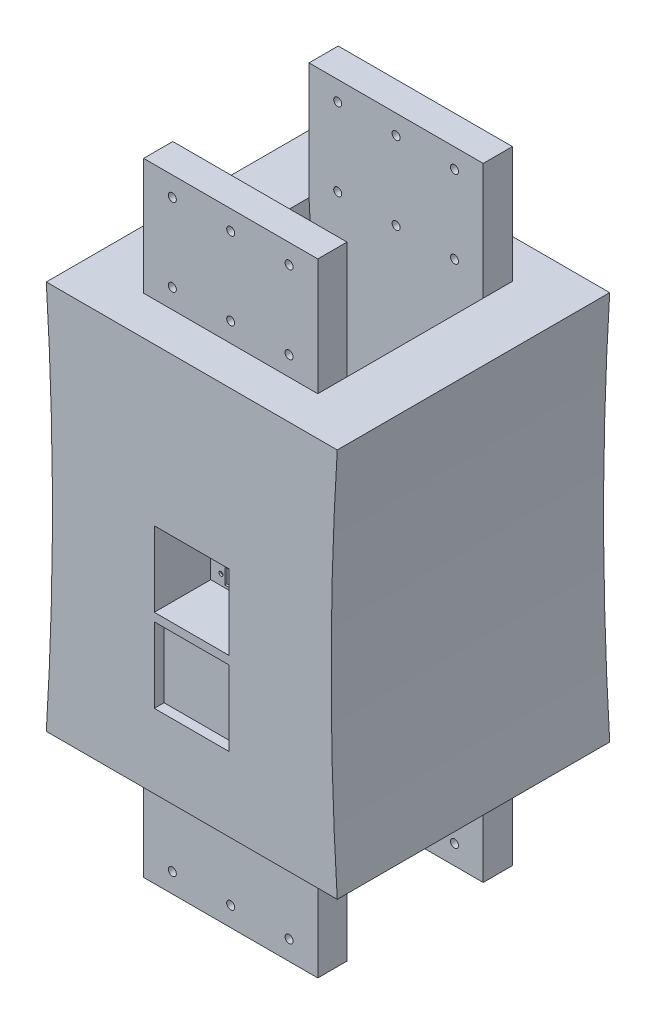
SolidWorks part; units mm, degrees
ref_plane "前视基准面" through (0, 0, 0) normal (0, 0, 1) x (1, 0, 0)
ref_plane "上视基准面" through (0, 0, 0) normal (0, 1, 0) x (1, 0, 0)
ref_plane "右视基准面" through (0, 0, 0) normal (1, 0, 0) x (0, 0, -1)
other "Configuration Table"
sketch "草图2" plane through (0, 0, 0) normal (0, 0, 1) x (1, 0, 0)
  line L1 (0, 0) -> (140, 0)
  line L2 (0, 0) -> (0, 60)
  line L3 (0, 60) -> (140, 60)
  line L4 (140, 0) -> (140, 60)
  line L5 (-30, 110) -> (170, 110)
  line L6 (-30, 110) -> (-30, -3)
  line L7 (-30, -3) -> (170, -3)
  line L8 (170, 110) -> (170, -3)
  dimension "D1" = 140
  dimension "D2" = 60
  dimension "D3" = 30
  dimension "D4" = 30
  dimension "D5" = 50
  dimension "D6" = 3
extrude "凸台-拉伸2" add sketch "草图2" along normal blind 90
sketch "草图4" plane through (0, -3, 0) normal (0, -1, 0) x (1, 0, 0)
  line L4 (-30, 0) -> (170, 0)
  line L5 (170, 0) -> (170, 90)
  line L6 (170, 90) -> (-30, 90)
  line L7 (-30, 90) -> (-30, 0)
  line L8 (-30, 0) -> (170, 0)
  line L9 (170, 0) -> (170, 90)
  line L10 (170, 90) -> (-30, 90)
  line L11 (-30, 90) -> (-30, 0)
  dimension "D1" = 0
extrude "切除-拉伸2" cut sketch "草图4" against normal blind 3
sketch "草图5" plane through (0, 110, 0) normal (0, 1, 0) x (1, 0, 0)
  line L0 (140, -7.5) -> (132.5, -7.5)
  line L1 (132.5, -7.5) -> (132.5, 0)
  line L2 (132.5, -7.5) -> (112.5, -7.5) construction
  line L3 (132.5, -7.5) -> (132.5, -17.5) construction
  line L4 (140, 0) -> (0, 0)
  line L5 (140, -90) -> (140, 0)
  line L6 (0, -90) -> (140, -90)
  line L7 (0, 0) -> (0, -90)
  line L8 (140, 0) -> (0, 0)
  line L9 (140, -90) -> (140, 0)
  line L10 (0, -90) -> (140, -90)
  line L11 (0, 0) -> (0, -90)
  line L12 (70, 0) -> (70, -50000) construction
  circle A0 centre (132.5, -7.5) radius 1.5
  circle A1 centre (112.5, -7.5) radius 1.5
  circle A2 centre (112.5, -17.5) radius 1.5
  circle A3 centre (132.5, -17.5) radius 1.5
  circle A4 centre (27.5, -7.5) radius 1.5
  circle A5 centre (7.5, -7.5) radius 1.5
  circle A6 centre (7.5, -17.5) radius 1.5
  circle A7 centre (27.5, -17.5) radius 1.5
  point P19 (70, 0)
  dimension "D4" = 3
  dimension "D2" = 7.5
  dimension "D3" = 7.5
  dimension "D7" = 20
  dimension "D8" = 10
  dimension "D9" = 20
  dimension "D1" = 0
  dimension "D5" = 2
  dimension "D6" = 2
extrude "切除-拉伸3" cut sketch "草图5" against normal through all contours A6 | A7 | A4 | A5 | A0 | A1 | A2 | A3
sketch "草图6" plane through (0, 0, 0) normal (0, 0, -1) x (-1, 0, 0)
  line L0 (-170, 80) -> (30, 80)
  line L8 (0, 0) -> (30, 0)
  line L9 (30, 0) -> (30, 110)
  line L10 (30, 110) -> (-170, 110)
  line L11 (-170, 110) -> (-170, 0)
  line L12 (-170, 0) -> (-140, 0)
  line L13 (-140, 0) -> (-140, 60)
  line L14 (-140, 60) -> (0, 60)
  line L15 (0, 60) -> (0, 0)
  line L16 (0, 0) -> (30, 0)
  line L17 (30, 0) -> (30, 110)
  line L18 (30, 110) -> (-170, 110)
  line L19 (-170, 110) -> (-170, 0)
  line L20 (-170, 0) -> (-140, 0)
  line L21 (-140, 0) -> (-140, 60)
  line L22 (-140, 60) -> (0, 60)
  line L23 (0, 60) -> (0, 0)
  dimension "D2" = 30
  dimension "D1" = 0
extrude "凸台-拉伸4" add sketch "草图6" along normal blind 50 contours L0 M13 M11 M12
sketch "草图7" plane through (0, 0, -50) normal (0, 0, -1) x (-1, 0, 0)
  line L0 (30, 110) -> (30, 710)
  line L1 (30, 710) -> (-170, 710)
  line L2 (-170, 710) -> (-170, 110)
  line L3 (-70, 710) -> (-70, -49290) construction
  line L4 (-170, 110) -> (-170, 80)
  line L5 (-170, 80) -> (30, 80)
  line L6 (30, 80) -> (30, 110)
  line L7 (30, 110) -> (-170, 110)
  line L8 (-170, 110) -> (-170, 80)
  line L9 (-170, 80) -> (30, 80)
  line L10 (30, 80) -> (30, 110)
  line L11 (30, 110) -> (-170, 110)
  line L12 (-170, 710) -> (-140, 710) construction
  arc A0 (-170, 710) -> (-170, 110) centre (-1741.6234, 410) cw
  arc A1 (30, 710) -> (30, 110) centre (1601.6234, 410) ccw
  arc A2 (-140, 710) -> (-140, 110) centre (-1711.6234, 410) cw
  arc A3 (0, 710) -> (0, 110) centre (1571.6234, 410) ccw
  point P9 (-70, 710)
  dimension "D3" = 1600
  dimension "D2" = 600
  dimension "D5" = 30
  dimension "D1" = 0
  dimension "D4" = 2
extrude "凸台-拉伸5" add sketch "草图7" against normal blind 140 separate body contours A2 L1 A0 L11 | L1 A3 A1 M10
sketch "草图8" plane through (0, 0, -50) normal (0, 0, -1) x (-1, 0, 0)
  line L0 (-170, 110) -> (-170, 410)
  line L1 (-170, 410) -> (-141.6234, 410)
  line L2 (-140, 710) -> (-170, 710)
  line L3 (-170, 110) -> (-140, 110)
  line L4 (-140, 710) -> (-170, 710)
  line L5 (-170, 110) -> (-140, 110)
  line L6 (-140, 710) -> (-10, 710)
  line L7 (-140, 110) -> (0, 110)
  line L9 (30, 710) -> (0, 710)
  line L10 (0, 110) -> (30, 110)
  line L11 (30, 710) -> (0, 710)
  line L12 (0, 110) -> (30, 110)
  arc A2 (-140, 110) -> (-140, 710) centre (-1711.6234, 410) ccw
  arc A3 (-170, 110) -> (-170, 710) centre (-1741.6234, 410) ccw
  arc A4 (-140, 110) -> (-140, 710) centre (-1711.6234, 410) ccw
  arc A5 (-170, 110) -> (-170, 710) centre (-1741.6234, 410) ccw
  arc A6 (0, 710) -> (0, 110) centre (1571.6234, 410) ccw
  arc A7 (30, 710) -> (30, 110) centre (1601.6234, 410) ccw
  arc A8 (0, 710) -> (0, 110) centre (1571.6234, 410) ccw
  arc A9 (30, 710) -> (30, 110) centre (1601.6234, 410) ccw
  dimension "D2" = 0
  dimension "D1" = 0
sketch "草图9" plane through (0, 0, 90) normal (0, 0, 1) x (1, 0, 0)
  line L0 (70, 110) -> (70, 310)
  line L1 (170, 110) -> (-30, 110) construction
  line L2 (70, 310) -> (70, 570)
  line L3 (-30, 710) -> (0, 710) construction
  line L4 (-30, 710) -> (0, 710)
  line L5 (70, 310) -> (70, 240)
  line L7 (70, 570) -> (-372.6545, 570)
  line L8 (70, 570) -> (70, 240)
  line L9 (70, 240) -> (-372.6545, 240)
  line L10 (-372.6545, 570) -> (-372.6545, 240)
  line L11 (70, 570) -> (444.9585, 570)
  line L12 (70, 570) -> (70, 240)
  line L13 (70, 240) -> (444.9585, 240)
  line L14 (444.9585, 570) -> (444.9585, 240)
  line L15 (-372.6545, 240) -> (444.9585, 240)
  line L16 (-372.6545, 240) -> (-372.6545, 39.0962)
  line L17 (-372.6545, 39.0962) -> (444.9585, 39.0962)
  line L18 (444.9585, 240) -> (444.9585, 39.0962)
  line L19 (-372.6545, 570) -> (444.9585, 570)
  line L20 (-372.6545, 570) -> (-372.6545, 815.6567)
  line L21 (-372.6545, 815.6567) -> (444.9585, 815.6567)
  line L22 (444.9585, 570) -> (444.9585, 815.6567)
  dimension "D3" = 70
  dimension "D1" = 200
  dimension "D2" = 260
  dimension "D4" = 442.6545
  dimension "D5" = 374.9585
extrude "切除-拉伸4" cut sketch "草图9" against normal through all
sketch "草图11" plane through (0, 0, 90) normal (0, 0, 1) x (1, 0, 0)
  line L8 (-30, 110) -> (-30, 0)
  line L9 (-30, 0) -> (0, 0)
  line L10 (0, 0) -> (0, 60)
  line L11 (0, 60) -> (140, 60)
  line L12 (140, 60) -> (140, 0)
  line L13 (140, 0) -> (170, 0)
  line L14 (170, 0) -> (170, 110)
  line L15 (170, 110) -> (-30, 110)
  line L16 (-30, 110) -> (-30, 0)
  line L17 (-30, 0) -> (0, 0)
  line L18 (0, 0) -> (0, 60)
  line L19 (0, 60) -> (140, 60)
  line L20 (140, 60) -> (140, 0)
  line L21 (140, 0) -> (170, 0)
  line L22 (170, 0) -> (170, 110)
  line L23 (170, 110) -> (-30, 110)
  dimension "D1" = 0
extrude "切除-拉伸5" cut sketch "草图11" against normal through all
sketch "草图12" plane through (0, 0, 90) normal (0, 0, 1) x (1, 0, 0)
  line L0 (20.3565, 570) -> (119.6435, 570)
  line L1 (0, 110) -> (140, 110)
  line L2 (20.3565, 570) -> (-9.6435, 570)
  line L3 (-30, 110) -> (0, 110)
  line L4 (20.3565, 570) -> (-9.6435, 570)
  line L6 (149.6435, 570) -> (119.6435, 570)
  line L7 (140, 110) -> (170, 110)
  line L8 (149.6435, 570) -> (119.6435, 570)
  line L12 (-30, 110) -> (0, 110)
  line L13 (140, 110) -> (170, 110)
  arc A2 (0, 110) -> (20.3565, 570) centre (-1571.6234, 410) ccw
  arc A3 (-30, 110) -> (-9.6435, 570) centre (-1601.6234, 410) ccw
  arc A4 (0, 110) -> (20.3565, 570) centre (-1571.6234, 410) ccw
  arc A5 (-30, 110) -> (-9.6435, 570) centre (-1601.6234, 410) ccw
  arc A6 (149.6435, 570) -> (170, 110) centre (1741.6234, 410) ccw
  arc A7 (119.6435, 570) -> (140, 110) centre (1711.6234, 410) ccw
  arc A8 (149.6435, 570) -> (170, 110) centre (1741.6234, 410) ccw
  arc A9 (119.6435, 570) -> (140, 110) centre (1711.6234, 410) ccw
  dimension "D1" = 0
  dimension "D2" = 0
extrude "凸台-拉伸7" add sketch "草图12" against normal blind 30 contours A9 L0 L1 M9
sketch "草图13" plane through (0, 0, 90) normal (0, 0, 1) x (1, 0, 0)
  line L0 (-4.7514, 310) -> (25.2486, 310)
  line L1 (114.7514, 310) -> (144.7514, 310)
  line L2 (20.3565, 570) -> (-9.6435, 570)
  line L3 (-30, 110) -> (0, 110)
  line L4 (20.3565, 570) -> (-9.6435, 570)
  line L6 (149.6435, 570) -> (119.6435, 570)
  line L7 (140, 110) -> (170, 110)
  line L8 (149.6435, 570) -> (119.6435, 570)
  line L12 (-30, 110) -> (0, 110)
  line L13 (140, 110) -> (170, 110)
  arc A2 (0, 110) -> (20.3565, 570) centre (-1571.6234, 410) ccw
  arc A3 (-30, 110) -> (-9.6435, 570) centre (-1601.6234, 410) ccw
  arc A4 (0, 110) -> (20.3565, 570) centre (-1571.6234, 410) ccw
  arc A5 (-30, 110) -> (-9.6435, 570) centre (-1601.6234, 410) ccw
  arc A6 (149.6435, 570) -> (170, 110) centre (1741.6234, 410) ccw
  arc A7 (119.6435, 570) -> (140, 110) centre (1711.6234, 410) ccw
  arc A8 (149.6435, 570) -> (170, 110) centre (1741.6234, 410) ccw
  arc A9 (119.6435, 570) -> (140, 110) centre (1711.6234, 410) ccw
  dimension "D1" = 0
  dimension "D2" = 0
extrude "切除-拉伸6" cut sketch "草图13" against normal through all contours A4 L0 M13 M12 | L1 A9 M13 M10
sketch "草图14" plane through (0, 0, -50) normal (0, 0, -1) x (-1, 0, 0)
  line L2 (-144.7514, 310) -> (-114.7514, 310)
  line L3 (-119.6435, 570) -> (-149.6435, 570)
  line L4 (-144.7514, 310) -> (-114.7514, 310)
  line L5 (-119.6435, 570) -> (-149.6435, 570)
  line L6 (-140, 110) -> (0, 110)
  line L7 (-20.3565, 570) -> (-119.6435, 570)
  line L8 (-140, 110) -> (0, 110)
  line L9 (-20.3565, 570) -> (-119.6435, 570)
  arc A2 (-144.7514, 310) -> (-149.6435, 570) centre (-1741.6234, 410) ccw
  arc A3 (-114.7514, 310) -> (-119.6435, 570) centre (-1711.6234, 410) ccw
  arc A4 (-144.7514, 310) -> (-149.6435, 570) centre (-1741.6234, 410) ccw
  arc A5 (-114.7514, 310) -> (-119.6435, 570) centre (-1711.6234, 410) ccw
  arc A8 (-114.7514, 310) -> (-119.6435, 570) centre (-1711.6234, 410) ccw
  arc A9 (-140, 110) -> (-114.7514, 310) centre (-1711.6234, 410) ccw
  arc A10 (-25.2486, 310) -> (0, 110) centre (1571.6234, 410) ccw
  arc A11 (-20.3565, 570) -> (-25.2486, 310) centre (1571.6234, 410) ccw
  arc A12 (-114.7514, 310) -> (-119.6435, 570) centre (-1711.6234, 410) ccw
  arc A13 (-140, 110) -> (-114.7514, 310) centre (-1711.6234, 410) ccw
  arc A14 (-25.2486, 310) -> (0, 110) centre (1571.6234, 410) ccw
  arc A15 (-20.3565, 570) -> (-25.2486, 310) centre (1571.6234, 410) ccw
  dimension "D1" = 0
  dimension "D2" = 0
extrude "凸台-拉伸8" add sketch "草图14" against normal blind 30 contours A15 L9 A13 L8 A14 M13
sketch "草图15" plane through (0, 0, -50) normal (0, 0, -1) x (-1, 0, 0)
  line L0 (-114.7514, 310) -> (-25.2486, 310)
  line L4 (9.6435, 570) -> (-149.6435, 570)
  line L5 (-144.7514, 310) -> (-114.7514, 310)
  line L6 (-140, 110) -> (0, 110)
  line L7 (-25.2486, 310) -> (4.7514, 310)
  line L8 (9.6435, 570) -> (-149.6435, 570)
  line L9 (-144.7514, 310) -> (-114.7514, 310)
  line L10 (-140, 110) -> (0, 110)
  line L11 (-25.2486, 310) -> (4.7514, 310)
  arc A4 (9.6435, 570) -> (4.7514, 310) centre (1601.6234, 410) ccw
  arc A5 (-144.7514, 310) -> (-149.6435, 570) centre (-1741.6234, 410) ccw
  arc A6 (-140, 110) -> (-114.7514, 310) centre (-1711.6234, 410) ccw
  arc A7 (-25.2486, 310) -> (0, 110) centre (1571.6234, 410) ccw
  arc A8 (9.6435, 570) -> (4.7514, 310) centre (1601.6234, 410) ccw
  arc A9 (-144.7514, 310) -> (-149.6435, 570) centre (-1741.6234, 410) ccw
  arc A10 (-140, 110) -> (-114.7514, 310) centre (-1711.6234, 410) ccw
  arc A11 (-25.2486, 310) -> (0, 110) centre (1571.6234, 410) ccw
  dimension "D1" = 0
extrude "切除-拉伸7" cut sketch "草图15" against normal blind 20 contours L0 M13 M14 M15
sketch "草图16" plane through (0, 0, 90) normal (0, 0, 1) x (1, 0, 0)
  line L5 (0, 110) -> (140, 110)
  line L6 (-4.7514, 310) -> (25.2486, 310)
  line L7 (149.6435, 570) -> (-9.6435, 570)
  line L9 (0, 110) -> (140, 110)
  line L11 (149.6435, 570) -> (-9.6435, 570)
  line L12 (-4.7514, 310) -> (25.2486, 310)
  line L13 (114.7514, 310) -> (144.7514, 310)
  line L14 (114.7514, 310) -> (144.7514, 310)
  arc A4 (0, 110) -> (25.2486, 310) centre (-1571.6234, 410) ccw
  arc A5 (0, 110) -> (25.2486, 310) centre (-1571.6234, 410) ccw
  arc A6 (149.6435, 570) -> (144.7514, 310) centre (1741.6234, 410) ccw
  arc A7 (-4.7514, 310) -> (-9.6435, 570) centre (-1601.6234, 410) ccw
  arc A10 (149.6435, 570) -> (144.7514, 310) centre (1741.6234, 410) ccw
  arc A11 (-4.7514, 310) -> (-9.6435, 570) centre (-1601.6234, 410) ccw
  arc A12 (114.7514, 310) -> (140, 110) centre (1711.6234, 410) ccw
  arc A13 (114.7514, 310) -> (140, 110) centre (1711.6234, 410) ccw
  dimension "D1" = 0
extrude "切除-拉伸8" cut sketch "草图16" against normal blind 20
sketch "草图17" plane through (0, 0, 70) normal (0, 0, 1) x (1, 0, 0)
  line L0 (70, 310) -> (70, -49690) construction
  line L1 (100, 250) -> (100, 260)
  line L2 (-4.7514, 310) -> (25.2486, 310)
  line L3 (0, 110) -> (140, 110)
  line L6 (100, 260) -> (70, 260) construction
  line L7 (100, 260) -> (100, 300) construction
  line L8 (100, 260) -> (70, 260) construction
  line L9 (100, 260) -> (100, 300) construction
  line L10 (-4.7514, 310) -> (25.2486, 310)
  line L11 (114.7514, 310) -> (144.7514, 310)
  line L12 (114.7514, 310) -> (144.7514, 310)
  line L13 (149.6435, 570) -> (-9.6435, 570)
  line L14 (149.6435, 570) -> (-9.6435, 570)
  line L17 (0, 110) -> (140, 110)
  circle A0 centre (100, 260) radius 2.0592
  circle A1 centre (70, 260) radius 2.0592
  arc A2 (0, 110) -> (25.2486, 310) centre (-1571.6234, 410) ccw
  arc A3 (114.7514, 310) -> (140, 110) centre (1711.6234, 410) ccw
  arc A4 (0, 110) -> (25.2486, 310) centre (-1571.6234, 410) ccw
  arc A5 (114.7514, 310) -> (140, 110) centre (1711.6234, 410) ccw
  circle A6 centre (40, 260) radius 2.0592
  circle A7 centre (70, 300) radius 2.0592
  circle A8 centre (40, 300) radius 2.0592
  arc A9 (-4.7514, 310) -> (-9.6435, 570) centre (-1601.6234, 410) ccw
  arc A10 (-4.7514, 310) -> (-9.6435, 570) centre (-1601.6234, 410) ccw
  arc A11 (149.6435, 570) -> (144.7514, 310) centre (1741.6234, 410) ccw
  arc A12 (149.6435, 570) -> (144.7514, 310) centre (1741.6234, 410) ccw
  circle A13 centre (100, 300) radius 2.0592
  circle A14 centre (100, 260) radius 5.3
  circle A15 centre (70, 260) radius 5.3
  circle A16 centre (40, 260) radius 5.3
  circle A17 centre (70, 300) radius 5.3
  circle A18 centre (40, 300) radius 5.3
  circle A19 centre (100, 300) radius 5.3
  dimension "D4" = 4.1184
  dimension "D3" = 10.6
  dimension "D2" = 10
  dimension "D5" = 3
  dimension "D7" = 90
  dimension "D8" = 30
  dimension "D9" = 40
  dimension "D10" = 3
  dimension "D12" = 90
  dimension "D13" = 30
  dimension "D14" = 10
  dimension "D1" = 0
  dimension "D6" = 2
  dimension "D11" = 2
extrude "切除-拉伸9" cut sketch "草图17" against normal blind 3 and the other way through all
sketch "草图19" plane through (0, 0, 70) normal (0, 0, 1) x (1, 0, 0)
  circle A1 centre (40, 300) radius 2.0592
  circle A2 centre (40, 300) radius 2.0592
  circle A3 centre (40, 260) radius 2.0592
  circle A4 centre (40, 260) radius 2.0592
  circle A5 centre (70, 260) radius 2.0592
  circle A6 centre (70, 260) radius 2.0592
  circle A7 centre (70, 300) radius 2.0592
  circle A8 centre (70, 300) radius 2.0592
  circle A9 centre (100, 300) radius 2.0592
  circle A10 centre (100, 300) radius 2.0592
  circle A11 centre (100, 260) radius 2.0592
  circle A12 centre (100, 260) radius 2.0592
  dimension "D1" = 0
  dimension "D2" = 0
  dimension "D3" = 0
  dimension "D4" = 0
  dimension "D5" = 0
  dimension "D6" = 0
extrude "切除-拉伸10" cut sketch "草图19" against normal through all
sketch "草图21" plane through (0, 0, 70) normal (0, 0, 1) x (1, 0, 0)
  line L0 (25.2486, 310) -> (114.7514, 310)
  line L4 (-4.7514, 310) -> (25.2486, 310)
  line L5 (0, 110) -> (140, 110)
  line L6 (114.7514, 310) -> (144.7514, 310)
  line L7 (149.6435, 570) -> (-9.6435, 570)
  line L8 (-4.7514, 310) -> (25.2486, 310)
  line L9 (0, 110) -> (140, 110)
  line L10 (114.7514, 310) -> (144.7514, 310)
  line L11 (149.6435, 570) -> (-9.6435, 570)
  arc A4 (-4.7514, 310) -> (-9.6435, 570) centre (-1601.6234, 410) ccw
  arc A5 (0, 110) -> (25.2486, 310) centre (-1571.6234, 410) ccw
  arc A6 (114.7514, 310) -> (140, 110) centre (1711.6234, 410) ccw
  arc A7 (149.6435, 570) -> (144.7514, 310) centre (1741.6234, 410) ccw
  arc A8 (-4.7514, 310) -> (-9.6435, 570) centre (-1601.6234, 410) ccw
  arc A9 (0, 110) -> (25.2486, 310) centre (-1571.6234, 410) ccw
  arc A10 (114.7514, 310) -> (140, 110) centre (1711.6234, 410) ccw
  arc A11 (149.6435, 570) -> (144.7514, 310) centre (1741.6234, 410) ccw
  dimension "D1" = 0
extrude "凸台-拉伸9" add sketch "草图21" along normal blind 20 contours L0 M16 M20 M21 M22 M15
sketch "草图22" plane through (0, 0, -30) normal (0, 0, -1) x (-1, 0, 0)
  line L0 (-76.2881, 310) -> (-76.2881, 250)
  line L1 (-76.2881, 250) -> (-119.6435, 250)
  line L2 (-25.2486, 310) -> (-114.7514, 310)
  line L3 (-140, 110) -> (0, 110)
  line L4 (-25.2486, 310) -> (-114.7514, 310)
  line L5 (-140, 110) -> (0, 110)
  line L6 (-76.2881, 250) -> (-20.3565, 250)
  arc A2 (-140, 110) -> (-114.7514, 310) centre (-1711.6234, 410) ccw
  arc A3 (-25.2486, 310) -> (0, 110) centre (1571.6234, 410) ccw
  arc A4 (-140, 110) -> (-114.7514, 310) centre (-1711.6234, 410) ccw
  arc A5 (-25.2486, 310) -> (0, 110) centre (1571.6234, 410) ccw
  dimension "D2" = 60
  dimension "D1" = 0
extrude "切除-拉伸11" cut sketch "草图22" against normal through all contours L6 L1 M13 M14 M15
sketch "草图23" plane through (0, 0, -20) normal (0, 0, 1) x (1, 0, 0)
  circle A0 centre (70, 300) radius 5.3 construction
  circle A1 centre (70, 300) radius 5.3
  circle A2 centre (40, 300) radius 5.3 construction
  circle A3 centre (40, 300) radius 5.3
  circle A4 centre (40, 260) radius 5.3 construction
  circle A5 centre (100, 300) radius 5.3
  circle A6 centre (100, 300) radius 5.3
  circle A7 centre (40, 260) radius 5.3
  circle A8 centre (70, 260) radius 5.3 construction
  circle A9 centre (70, 260) radius 5.3
  circle A10 centre (100, 260) radius 5.3 construction
  circle A11 centre (100, 260) radius 5.3
  dimension "D1" = 0
extrude "切除-拉伸12" cut sketch "草图23" against normal blind 3
sketch "草图24" plane through (0, 0, 60) normal (0, 0, -1) x (-1, 0, 0)
  circle A0 centre (-100, 300) radius 5.3 construction
  circle A1 centre (-100, 300) radius 5.3
  circle A2 centre (-100, 260) radius 5.3 construction
  circle A3 centre (-100, 260) radius 5.3
  circle A4 centre (-70, 260) radius 5.3 construction
  circle A5 centre (-70, 260) radius 5.3
  circle A6 centre (-70, 300) radius 5.3 construction
  circle A7 centre (-70, 300) radius 5.3
  circle A8 centre (-40, 260) radius 5.3 construction
  circle A9 centre (-40, 300) radius 5.3
  circle A10 centre (-40, 300) radius 5.3
  circle A11 centre (-40, 260) radius 5.3
  dimension "D1" = 0
extrude "切除-拉伸13" cut sketch "草图24" against normal blind 3
sketch "草图25" plane through (0, 0, 70) normal (0, 0, 1) x (1, 0, 0)
  circle A0 centre (40, 300) radius 5.3 construction
  circle A1 centre (40, 300) radius 5.3
  circle A2 centre (100, 300) radius 5.3 construction
  circle A3 centre (70, 300) radius 5.3
  circle A4 centre (70, 300) radius 5.3
  circle A5 centre (100, 300) radius 5.3
  circle A6 centre (40, 260) radius 5.3 construction
  circle A7 centre (40, 260) radius 5.3
  circle A8 centre (70, 260) radius 5.3 construction
  circle A9 centre (70, 260) radius 5.3
  circle A10 centre (100, 260) radius 5.3 construction
  circle A11 centre (100, 260) radius 5.3
  circle A12 centre (40, 300) radius 2.0592 construction
  circle A13 centre (40, 300) radius 2.0592
  circle A14 centre (40, 260) radius 2.0592 construction
  circle A15 centre (40, 260) radius 2.0592
  circle A16 centre (70, 300) radius 2.0592 construction
  circle A17 centre (70, 300) radius 2.0592
  circle A18 centre (70, 260) radius 2.0592 construction
  circle A19 centre (70, 260) radius 2.0592
  circle A20 centre (100, 300) radius 2.0592 construction
  circle A21 centre (100, 300) radius 2.0592
  circle A22 centre (100, 260) radius 2.0592 construction
  circle A23 centre (100, 260) radius 2.0592
  dimension "D1" = 0
extrude "凸台-拉伸11" add sketch "草图25" against normal blind 3 separate body
sketch "草图26" plane through (0, 0, 90) normal (0, 0, 1) x (1, 0, 0)
  line L0 (55.2486, 310) -> (55.2486, 510)
  line L1 (25.2486, 310) -> (114.7514, 310) construction
  line L2 (55.2486, 510) -> (-4.7514, 510)
  line L3 (-4.7514, 510) -> (144.7514, 510)
  line L4 (-4.7514, 310) -> (144.7514, 310)
  line L5 (149.6435, 570) -> (-9.6435, 570)
  line L6 (-4.7514, 310) -> (144.7514, 310)
  line L7 (149.6435, 570) -> (-9.6435, 570)
  line L8 (55.2486, 410) -> (-49944.7514, 410) construction
  line L9 (20.3565, 570) -> (119.6435, 570)
  line L11 (20.3565, 250) -> (119.6435, 250)
  line L12 (114.7514, 310) -> (25.2486, 310)
  line L13 (20.3565, 250) -> (119.6435, 250)
  line L14 (114.7514, 310) -> (25.2486, 310)
  arc A2 (20.3565, 570) -> (25.2486, 510) centre (-1571.6234, 410) cw
  arc A3 (114.7514, 510) -> (119.6435, 570) centre (1711.6234, 410) cw
  arc A4 (149.6435, 570) -> (144.7514, 310) centre (1741.6234, 410) ccw
  arc A5 (-4.7514, 310) -> (-9.6435, 570) centre (-1601.6234, 410) ccw
  arc A6 (149.6435, 570) -> (144.7514, 310) centre (1741.6234, 410) ccw
  arc A7 (-4.7514, 310) -> (-9.6435, 570) centre (-1601.6234, 410) ccw
  arc A8 (20.3565, 250) -> (25.2486, 310) centre (-1571.6234, 410) ccw
  arc A9 (114.7514, 310) -> (119.6435, 250) centre (1711.6234, 410) ccw
  arc A10 (20.3565, 250) -> (25.2486, 310) centre (-1571.6234, 410) ccw
  arc A11 (114.7514, 310) -> (119.6435, 250) centre (1711.6234, 410) ccw
  point P4 (55.2486, 410)
  dimension "D3" = 60
  dimension "D4" = 0
  dimension "D2" = 0
extrude "切除-拉伸14" cut sketch "草图26" against normal through all contours A2 L3 M8 M9 | A3 L3 M7 M8
sketch "草图29" plane through (0, 0, -50) normal (0, 0, -1) x (-1, 0, 0)
  line L0 (-141.6234, 410) -> (49858.3766, 410) construction
  line L1 (-114.7514, 510) -> (-25.2486, 510)
  line L4 (4.7514, 510) -> (-25.2486, 510)
  line L5 (-20.3565, 570) -> (-119.6435, 570)
  line L6 (-114.7514, 510) -> (-144.7514, 510)
  line L7 (-144.7514, 310) -> (4.7514, 310)
  line L8 (4.7514, 510) -> (-25.2486, 510)
  line L9 (-20.3565, 570) -> (-119.6435, 570)
  line L10 (-114.7514, 510) -> (-144.7514, 510)
  line L11 (-144.7514, 310) -> (4.7514, 310)
  circle A0 centre (-40, 260) radius 2.0592 construction
  circle A1 centre (-40, 300) radius 2.0592 construction
  circle A2 centre (-70, 300) radius 2.0592 construction
  circle A3 centre (-70, 260) radius 2.0592 construction
  arc A4 (-20.3565, 570) -> (-25.2486, 510) centre (1571.6234, 410) ccw
  arc A5 (-114.7514, 510) -> (-119.6435, 570) centre (-1711.6234, 410) ccw
  arc A6 (-144.7514, 310) -> (-144.7514, 510) centre (-1741.6234, 410) ccw
  arc A7 (4.7514, 510) -> (4.7514, 310) centre (1601.6234, 410) ccw
  arc A8 (-20.3565, 570) -> (-25.2486, 510) centre (1571.6234, 410) ccw
  arc A9 (-114.7514, 510) -> (-119.6435, 570) centre (-1711.6234, 410) ccw
  arc A10 (-144.7514, 310) -> (-144.7514, 510) centre (-1741.6234, 410) ccw
  arc A11 (4.7514, 510) -> (4.7514, 310) centre (1601.6234, 410) ccw
  circle A12 centre (-100, 260) radius 2.0592 construction
  circle A13 centre (-100, 300) radius 2.0592 construction
  circle A14 centre (-40, 260) radius 2.0592
  circle A15 centre (-40, 300) radius 2.0592
  circle A16 centre (-70, 300) radius 2.0592
  circle A17 centre (-70, 260) radius 2.0592
  circle A18 centre (-100, 260) radius 2.0592
  circle A19 centre (-100, 300) radius 2.0592
  circle A20 centre (-70, 520) radius 2.0592
  circle A21 centre (-100, 520) radius 2.0592
  circle A22 centre (-100, 560) radius 2.0592
  circle A23 centre (-70, 560) radius 2.0592
  circle A24 centre (-40, 560) radius 2.0592
  circle A25 centre (-40, 520) radius 2.0592
  point P12 (-141.6234, 410)
  dimension "D1" = 0
extrude "切除-拉伸16" cut sketch "草图29" against normal blind 20 contours L1 A24 A22 A20 A21 A23 A25 M13 M11 M12
sketch "草图30" plane through (0, 0, -50) normal (0, 0, -1) x (-1, 0, 0)
  circle A1 centre (-100, 520) radius 2.0592
  circle A3 centre (-100, 560) radius 2.0592
  circle A5 centre (-70, 560) radius 2.0592
  circle A7 centre (-70, 520) radius 2.0592
  circle A9 centre (-40, 560) radius 2.0592
  circle A11 centre (-40, 520) radius 2.0592
  circle A13 centre (-100, 520) radius 2.0592
  circle A14 centre (-100, 560) radius 2.0592
  circle A15 centre (-70, 560) radius 2.0592
  circle A17 centre (-70, 520) radius 2.0592
  circle A19 centre (-40, 560) radius 2.0592
  circle A21 centre (-40, 520) radius 2.0592
  dimension "D1" = 0
  dimension "D2" = 0
  dimension "D3" = 0
  dimension "D4" = 0
  dimension "D5" = 0
  dimension "D6" = 0
extrude "切除-拉伸17" cut sketch "草图30" against normal through all both and the other way through all
sketch "草图31" plane through (0, 0, 90) normal (0, 0, 1) x (1, 0, 0)
  line L2 (25.2486, 510) -> (114.7514, 510)
  line L3 (119.6435, 570) -> (20.3565, 570)
  line L4 (25.2486, 510) -> (114.7514, 510)
  line L5 (119.6435, 570) -> (20.3565, 570)
  arc A2 (119.6435, 570) -> (114.7514, 510) centre (1711.6234, 410) ccw
  arc A3 (25.2486, 510) -> (20.3565, 570) centre (-1571.6234, 410) ccw
  arc A4 (119.6435, 570) -> (114.7514, 510) centre (1711.6234, 410) ccw
  arc A5 (25.2486, 510) -> (20.3565, 570) centre (-1571.6234, 410) ccw
  dimension "D1" = 0
extrude "切除-拉伸18" cut sketch "草图31" against normal blind 20 and the other way through all
sketch "草图32" plane through (0, 0, -20) normal (0, 0, 1) x (1, 0, 0)
  line L0 (-1.6234, 410) -> (49998.3766, 410) construction
  arc A0 (-4.7514, 310) -> (-4.7514, 510) centre (-1601.6234, 410) ccw construction
  circle A1 centre (40, 300) radius 5.3 construction
  circle A2 centre (40, 300) radius 5.3
  circle A3 centre (70, 260) radius 5.3 construction
  circle A4 centre (100, 260) radius 5.3 construction
  circle A5 centre (100, 300) radius 5.3 construction
  circle A6 centre (70, 300) radius 5.3 construction
  circle A7 centre (40, 260) radius 5.3 construction
  circle A8 centre (70, 260) radius 5.3
  circle A9 centre (100, 260) radius 5.3
  circle A10 centre (100, 300) radius 5.3
  circle A11 centre (70, 300) radius 5.3
  circle A12 centre (40, 260) radius 5.3
  circle A13 centre (100, 560) radius 5.3
  circle A14 centre (70, 560) radius 5.3
  circle A15 centre (40, 560) radius 5.3
  circle A16 centre (40, 520) radius 5.3
  circle A17 centre (100, 520) radius 5.3
  circle A18 centre (70, 520) radius 5.3
  point P5 (-1.6234, 410)
extrude "切除-拉伸19" cut sketch "草图32" against normal blind 3
sketch "草图33" plane through (0, 0, 60) normal (0, 0, -1) x (-1, 0, 0)
  circle A0 centre (-100, 560) radius 5.3 construction
  circle A1 centre (-100, 560) radius 5.3
  circle A2 centre (-100, 520) radius 5.3 construction
  circle A3 centre (-100, 520) radius 5.3
  circle A4 centre (-70, 520) radius 5.3 construction
  circle A5 centre (-70, 520) radius 5.3
  circle A6 centre (-40, 520) radius 5.3 construction
  circle A7 centre (-40, 520) radius 5.3
  circle A8 centre (-40, 560) radius 5.3 construction
  circle A9 centre (-40, 560) radius 5.3
  circle A10 centre (-70, 560) radius 5.3 construction
  circle A11 centre (-70, 560) radius 5.3
extrude "切除-拉伸20" cut sketch "草图33" against normal blind 3
sketch "草图35" plane through (0, 0, 90) normal (0, 0, 1) x (1, 0, 0)
  line L0 (70, 510) -> (70, 310)
  line L2 (144.7514, 510) -> (-4.7514, 510)
  line L3 (-4.7514, 310) -> (144.7514, 310)
  line L4 (144.7514, 510) -> (-4.7514, 510)
  line L5 (-4.7514, 310) -> (144.7514, 310)
  line L6 (50.75, 429.25) -> (89.25, 429.25)
  line L7 (50.75, 429.25) -> (50.75, 390.75)
  line L8 (50.75, 390.75) -> (89.25, 390.75)
  line L9 (89.25, 429.25) -> (89.25, 390.75)
  line L10 (50.75, 429.25) -> (89.25, 390.75) construction
  line L11 (50.75, 390.75) -> (89.25, 429.25) construction
  arc A2 (144.7514, 510) -> (144.7514, 310) centre (1741.6234, 410) ccw
  arc A3 (-4.7514, 310) -> (-4.7514, 510) centre (-1601.6234, 410) ccw
  arc A4 (144.7514, 510) -> (144.7514, 310) centre (1741.6234, 410) ccw
  arc A5 (-4.7514, 310) -> (-4.7514, 510) centre (-1601.6234, 410) ccw
  point P8 (70, 410)
  dimension "D2" = 38.5
  dimension "D3" = 38.5
  dimension "D1" = 0
extrude "切除-拉伸21" cut sketch "草图35" against normal blind 29 contours L7 L8 L0 L6 | L9 L6 L0 L8
sketch "草图36" plane through (0, 0, 61) normal (0, 0, 1) x (1, 0, 0)
  line L4 (50.75, 429.25) -> (50.75, 390.75)
  line L5 (50.75, 390.75) -> (89.25, 390.75)
  line L6 (89.25, 390.75) -> (89.25, 429.25)
  line L7 (89.25, 429.25) -> (50.75, 429.25)
  line L8 (50.75, 429.25) -> (50.75, 390.75)
  line L9 (50.75, 390.75) -> (89.25, 390.75)
  line L10 (89.25, 390.75) -> (89.25, 429.25)
  line L11 (89.25, 429.25) -> (50.75, 429.25)
  dimension "D1" = 0
extrude "凸台-拉伸12" add sketch "草图36" against normal blind 2
sketch "草图37" plane through (0, 0, 61) normal (0, 0, 1) x (1, 0, 0)
  line L0 (50.75, 410) -> (89.25, 410)
  line L1 (70, 410) -> (70, 424)
  line L2 (70, 424) -> (84, 424)
  line L4 (50.75, 429.25) -> (50.75, 390.75)
  line L5 (50.75, 390.75) -> (89.25, 390.75)
  line L6 (89.25, 390.75) -> (89.25, 429.25)
  line L7 (89.25, 429.25) -> (50.75, 429.25)
  line L8 (50.75, 429.25) -> (50.75, 390.75)
  line L9 (50.75, 390.75) -> (89.25, 390.75)
  line L10 (89.25, 390.75) -> (89.25, 429.25)
  line L11 (89.25, 429.25) -> (50.75, 429.25)
  circle A0 centre (84, 424) radius 1.05
  circle A1 centre (84, 396) radius 1.05
  circle A2 centre (56, 396) radius 1.05
  circle A3 centre (56, 424) radius 1.05
  dimension "D4" = 2.1
  dimension "D2" = 14
  dimension "D3" = 14
  dimension "D1" = 0
extrude "切除-拉伸22" cut sketch "草图37" against normal blind 3 contours A2 | A1 | A0 | A3
sketch "草图39" plane through (0, 0, 61) normal (0, 0, 1) x (1, 0, 0)
  line L0 (84, 396) -> (82, 396)
  line L1 (82, 396) -> (82, 400)
  line L2 (82, 400) -> (70, 400)
  line L3 (70, 400) -> (70, 392)
  line L4 (50.75, 429.25) -> (50.75, 390.75)
  line L5 (50.75, 390.75) -> (89.25, 390.75)
  line L6 (89.25, 390.75) -> (89.25, 429.25)
  line L7 (89.25, 429.25) -> (50.75, 429.25)
  line L8 (50.75, 429.25) -> (50.75, 390.75)
  line L9 (50.75, 390.75) -> (89.25, 390.75)
  line L10 (89.25, 390.75) -> (89.25, 429.25)
  line L11 (89.25, 429.25) -> (50.75, 429.25)
  line L12 (70, 392) -> (82, 392)
  line L13 (82, 392) -> (82, 396)
  line L14 (70, 390.75) -> (70, 50390.75) construction
  line L15 (50.75, 410) -> (50050.75, 410) construction
  line L16 (58, 396) -> (58, 400)
  line L17 (58, 392) -> (58, 396)
  line L18 (70, 392) -> (58, 392)
  line L19 (70, 400) -> (70, 392)
  line L20 (58, 400) -> (70, 400)
  line L21 (82, 424) -> (82, 420)
  line L22 (82, 428) -> (82, 424)
  line L23 (58, 428) -> (82, 428)
  line L24 (70, 420) -> (70, 428)
  line L25 (82, 420) -> (58, 420)
  line L26 (58, 424) -> (58, 420)
  line L27 (58, 428) -> (58, 424)
  circle A0 centre (84, 396) radius 1.05 construction
  circle A1 centre (84, 396) radius 1.05
  circle A2 centre (56, 424) radius 1.05 construction
  circle A3 centre (56, 424) radius 1.05
  circle A5 centre (84, 424) radius 1.05 construction
  circle A6 centre (84, 424) radius 1.05
  circle A7 centre (56, 396) radius 1.05 construction
  circle A8 centre (56, 396) radius 1.05
  point P19 (70, 390.75)
  point P20 (50.75, 410)
  dimension "D2" = 2
  dimension "D3" = 12
  dimension "D4" = 8
  dimension "D5" = 4
  dimension "D1" = 0
extrude "切除-拉伸23" cut sketch "草图39" against normal blind 30 contours L20 L16 L17 L18 L19 | L12 L13 L1 L2 L3 | L23 L27 L26 L25 L24 | L25 L21 L22 L23 L24 | A3 | A8 | A1 | A6
sketch "草图40" plane through (0, 0, 60) normal (0, 0, -1) x (-1, 0, 0)
  line L2 (-119.6435, 250) -> (-20.3565, 250)
  line L3 (-20.3565, 570) -> (-119.6435, 570)
  line L4 (-119.6435, 250) -> (-20.3565, 250)
  arc A6 (-25.2486, 310) -> (-20.3565, 250) centre (1571.6234, 410) ccw
  arc A7 (-25.2486, 510) -> (-25.2486, 310) centre (1571.6234, 410) ccw
  arc A8 (-20.3565, 570) -> (-25.2486, 510) centre (1571.6234, 410) ccw
  arc A9 (-114.7514, 510) -> (-119.6435, 570) centre (-1711.6234, 410) ccw
  arc A10 (-114.7514, 310) -> (-114.7514, 510) centre (-1711.6234, 410) ccw
  arc A11 (-119.6435, 250) -> (-114.7514, 310) centre (-1711.6234, 410) ccw
  arc A12 (-25.2486, 310) -> (-20.3565, 250) centre (1571.6234, 410) ccw
  arc A13 (-25.2486, 510) -> (-25.2486, 310) centre (1571.6234, 410) ccw
  arc A14 (-20.3565, 570) -> (-25.2486, 510) centre (1571.6234, 410) ccw
  arc A15 (-114.7514, 510) -> (-119.6435, 570) centre (-1711.6234, 410) ccw
  arc A16 (-114.7514, 310) -> (-114.7514, 510) centre (-1711.6234, 410) ccw
  arc A17 (-119.6435, 250) -> (-114.7514, 310) centre (-1711.6234, 410) ccw
  circle A24 centre (-100, 560) radius 5.5
  circle A25 centre (-70, 560) radius 5.5
  circle A26 centre (-40, 560) radius 5.5
  circle A27 centre (-70, 520) radius 5.5
  circle A28 centre (-40, 520) radius 5.5
  circle A29 centre (-100, 520) radius 5.5
  dimension "D2" = 11
  dimension "D1" = 0
  dimension "D3" = 3
  dimension "D4" = 2
extrude "切除-拉伸24" cut sketch "草图40" against normal blind 3 contours A25 | A26 | A24 | A28 | A27 | A29
sketch "草图41" plane through (0, 0, -20) normal (0, 0, 1) x (1, 0, 0)
  circle A0 centre (100, 560) radius 5.5 construction
  circle A1 centre (40, 560) radius 5.5 construction
  circle A2 centre (70, 560) radius 5.5 construction
  circle A3 centre (100, 560) radius 5.5
  circle A4 centre (40, 560) radius 5.5
  circle A5 centre (70, 560) radius 5.5
  circle A6 centre (40, 520) radius 5.5 construction
  circle A7 centre (70, 520) radius 5.5 construction
  circle A8 centre (100, 520) radius 5.5 construction
  circle A9 centre (40, 520) radius 5.5
  circle A10 centre (70, 520) radius 5.5
  circle A11 centre (100, 520) radius 5.5
extrude "切除-拉伸25" cut sketch "草图41" against normal blind 3
sketch "草图42" plane through (0, 0, 60) normal (0, 0, -1) x (-1, 0, 0)
  line L0 (-111.6234, 410) -> (-50111.6234, 410) construction
  line L2 (-119.6435, 250) -> (-20.3565, 250)
  line L3 (-20.3565, 570) -> (-119.6435, 570)
  line L4 (-119.6435, 250) -> (-20.3565, 250)
  line L5 (-20.3565, 570) -> (-119.6435, 570)
  circle A0 centre (-40, 520) radius 5.5 construction
  circle A1 centre (-70, 520) radius 5.5 construction
  circle A2 centre (-70, 560) radius 5.5 construction
  circle A3 centre (-40, 560) radius 5.5 construction
  circle A4 centre (-100, 560) radius 5.5 construction
  circle A5 centre (-100, 520) radius 5.5 construction
  arc A6 (-25.2486, 310) -> (-20.3565, 250) centre (1571.6234, 410) ccw
  arc A7 (-25.2486, 510) -> (-25.2486, 310) centre (1571.6234, 410) ccw
  arc A8 (-20.3565, 570) -> (-25.2486, 510) centre (1571.6234, 410) ccw
  arc A9 (-114.7514, 510) -> (-119.6435, 570) centre (-1711.6234, 410) ccw
  arc A10 (-114.7514, 310) -> (-114.7514, 510) centre (-1711.6234, 410) ccw
  arc A11 (-119.6435, 250) -> (-114.7514, 310) centre (-1711.6234, 410) ccw
  arc A12 (-25.2486, 310) -> (-20.3565, 250) centre (1571.6234, 410) ccw
  arc A13 (-25.2486, 510) -> (-25.2486, 310) centre (1571.6234, 410) ccw
  arc A15 (-114.7514, 510) -> (-119.6435, 570) centre (-1711.6234, 410) ccw
  arc A16 (-114.7514, 310) -> (-114.7514, 510) centre (-1711.6234, 410) ccw
  arc A17 (-119.6435, 250) -> (-114.7514, 310) centre (-1711.6234, 410) ccw
  circle A18 centre (-40, 520) radius 5.5
  circle A19 centre (-70, 520) radius 5.5
  circle A20 centre (-70, 560) radius 5.5
  circle A21 centre (-40, 560) radius 5.5
  circle A22 centre (-100, 560) radius 5.5
  circle A23 centre (-100, 520) radius 5.5
  circle A24 centre (-40, 300) radius 5.5
  circle A25 centre (-70, 300) radius 5.5
  circle A26 centre (-100, 300) radius 5.5
  circle A27 centre (-100, 260) radius 5.5
  circle A28 centre (-70, 260) radius 5.5
  circle A29 centre (-40, 260) radius 5.5
  point P8 (-111.6234, 410)
  dimension "D1" = 0
extrude "切除-拉伸26" cut sketch "草图42" against normal blind 3 contours A24 | A25 | A26 | A27 | A28 | A29
sketch "草图43" plane through (0, 0, -20) normal (0, 0, 1) x (1, 0, 0)
  line L0 (111.6234, 410) -> (50111.6234, 410) construction
  line L2 (20.3565, 250) -> (119.6435, 250)
  line L3 (119.6435, 570) -> (20.3565, 570)
  line L4 (20.3565, 250) -> (119.6435, 250)
  line L5 (119.6435, 570) -> (20.3565, 570)
  circle A0 centre (40, 520) radius 5.5 construction
  circle A1 centre (70, 520) radius 5.5 construction
  circle A2 centre (100, 520) radius 5.5 construction
  circle A3 centre (100, 560) radius 5.5 construction
  circle A4 centre (70, 560) radius 5.5 construction
  circle A5 centre (40, 560) radius 5.5 construction
  arc A6 (114.7514, 310) -> (119.6435, 250) centre (1711.6234, 410) ccw
  arc A7 (114.7514, 510) -> (114.7514, 310) centre (1711.6234, 410) ccw
  arc A8 (119.6435, 570) -> (114.7514, 510) centre (1711.6234, 410) ccw
  arc A9 (25.2486, 510) -> (20.3565, 570) centre (-1571.6234, 410) ccw
  arc A10 (25.2486, 310) -> (25.2486, 510) centre (-1571.6234, 410) ccw
  arc A11 (20.3565, 250) -> (25.2486, 310) centre (-1571.6234, 410) ccw
  arc A12 (114.7514, 310) -> (119.6435, 250) centre (1711.6234, 410) ccw
  arc A14 (119.6435, 570) -> (114.7514, 510) centre (1711.6234, 410) ccw
  arc A15 (25.2486, 510) -> (20.3565, 570) centre (-1571.6234, 410) ccw
  arc A16 (25.2486, 310) -> (25.2486, 510) centre (-1571.6234, 410) ccw
  arc A17 (20.3565, 250) -> (25.2486, 310) centre (-1571.6234, 410) ccw
  circle A18 centre (40, 520) radius 5.5
  circle A19 centre (70, 520) radius 5.5
  circle A20 centre (100, 520) radius 5.5
  circle A21 centre (100, 560) radius 5.5
  circle A22 centre (70, 560) radius 5.5
  circle A23 centre (40, 560) radius 5.5
  circle A24 centre (100, 300) radius 5.5
  circle A25 centre (100, 260) radius 5.5
  circle A26 centre (70, 260) radius 5.5
  circle A27 centre (40, 260) radius 5.5
  circle A28 centre (40, 300) radius 5.5
  circle A29 centre (70, 300) radius 5.5
  dimension "D1" = 0
extrude "切除-拉伸27" cut sketch "草图43" against normal blind 3 contours A25 | A26 | A24 | A29 | A27 | A28
sketch "草图44" plane through (0, 0, -20) normal (0, 0, 1) x (1, 0, 0)
  line L0 (25.2486, 510) -> (25.2486, 570)
  line L1 (114.7514, 510) -> (114.7514, 570)
  line L2 (20.3565, 250) -> (119.6435, 250)
  line L3 (119.6435, 570) -> (20.3565, 570)
  line L4 (20.3565, 250) -> (119.6435, 250)
  line L5 (119.6435, 570) -> (20.3565, 570)
  arc A6 (114.7514, 310) -> (119.6435, 250) centre (1711.6234, 410) ccw
  arc A7 (114.7514, 510) -> (114.7514, 310) centre (1711.6234, 410) ccw
  arc A8 (119.6435, 570) -> (114.7514, 510) centre (1711.6234, 410) ccw
  arc A9 (25.2486, 510) -> (20.3565, 570) centre (-1571.6234, 410) ccw
  arc A10 (25.2486, 310) -> (25.2486, 510) centre (-1571.6234, 410) ccw
  arc A11 (20.3565, 250) -> (25.2486, 310) centre (-1571.6234, 410) ccw
  arc A12 (114.7514, 310) -> (119.6435, 250) centre (1711.6234, 410) ccw
  arc A13 (114.7514, 510) -> (114.7514, 310) centre (1711.6234, 410) ccw
  arc A14 (119.6435, 570) -> (114.7514, 510) centre (1711.6234, 410) ccw
  arc A15 (25.2486, 510) -> (20.3565, 570) centre (-1571.6234, 410) ccw
  arc A16 (25.2486, 310) -> (25.2486, 510) centre (-1571.6234, 410) ccw
  arc A17 (20.3565, 250) -> (25.2486, 310) centre (-1571.6234, 410) ccw
  dimension "D1" = 0
extrude "切除-拉伸28" cut sketch "草图44" against normal through all both and the other way through all contours L0 M31 M30 | L1 M29 M30
sketch "草图45" plane through (0, 0, 70) normal (0, 0, 1) x (1, 0, 0)
  line L0 (25.2486, 310) -> (25.2486, 250)
  line L1 (114.7514, 310) -> (114.7514, 250)
  line L2 (20.3565, 250) -> (119.6435, 250)
  line L3 (114.7514, 310) -> (25.2486, 310)
  line L4 (20.3565, 250) -> (119.6435, 250)
  line L5 (114.7514, 310) -> (25.2486, 310)
  arc A2 (20.3565, 250) -> (25.2486, 310) centre (-1571.6234, 410) ccw
  arc A3 (114.7514, 310) -> (119.6435, 250) centre (1711.6234, 410) ccw
  arc A4 (20.3565, 250) -> (25.2486, 310) centre (-1571.6234, 410) ccw
  arc A5 (114.7514, 310) -> (119.6435, 250) centre (1711.6234, 410) ccw
  dimension "D1" = 0
extrude "切除-拉伸29" cut sketch "草图45" against normal through all both and the other way through all contours L0 M11 M12 | L1 M13 M12
sketch "草图46" plane through (0, 0, 60) normal (0, 0, -1) x (-1, 0, 0)
  circle A0 centre (-100, 300) radius 2.0592 construction
  circle A1 centre (-100, 300) radius 2.0592
  circle A2 centre (-100, 300) radius 5.5 construction
  circle A3 centre (-100, 300) radius 5.5
  circle A4 centre (-100, 260) radius 2.0592 construction
  circle A5 centre (-100, 260) radius 5.5 construction
  circle A6 centre (-100, 260) radius 2.0592
  circle A7 centre (-100, 260) radius 5.5
  circle A8 centre (-70, 300) radius 2.0592 construction
  circle A9 centre (-70, 300) radius 5.5 construction
  circle A10 centre (-70, 300) radius 2.0592
  circle A11 centre (-70, 300) radius 5.5
  circle A12 centre (-70, 260) radius 2.0592 construction
  circle A13 centre (-70, 260) radius 5.5 construction
  circle A14 centre (-70, 260) radius 2.0592
  circle A15 centre (-70, 260) radius 5.5
  circle A16 centre (-40, 300) radius 2.0592 construction
  circle A17 centre (-40, 300) radius 5.5 construction
  circle A18 centre (-40, 300) radius 2.0592
  circle A19 centre (-40, 300) radius 5.5
  circle A20 centre (-40, 260) radius 2.0592 construction
  circle A21 centre (-40, 260) radius 2.0592
  circle A22 centre (-40, 260) radius 5.5 construction
  circle A23 centre (-40, 260) radius 5.5
extrude "凸台-拉伸13" add sketch "草图46" against normal blind 10
sketch "草图47" plane through (0, 0, -20) normal (0, 0, 1) x (1, 0, 0)
  circle A0 centre (100, 300) radius 2.0592 construction
  circle A1 centre (70, 300) radius 2.0592 construction
  circle A2 centre (40, 300) radius 2.0592 construction
  circle A3 centre (100, 300) radius 2.0592
  circle A4 centre (70, 300) radius 2.0592
  circle A5 centre (40, 300) radius 2.0592
  circle A6 centre (100, 260) radius 5.5 construction
  circle A7 centre (70, 260) radius 5.5 construction
  circle A8 centre (40, 260) radius 5.5 construction
  circle A9 centre (100, 260) radius 2.0592 construction
  circle A10 centre (70, 260) radius 2.0592 construction
  circle A11 centre (40, 260) radius 2.0592 construction
  circle A12 centre (100, 260) radius 5.5
  circle A13 centre (70, 260) radius 5.5
  circle A14 centre (40, 260) radius 5.5
  circle A15 centre (100, 260) radius 2.0592
  circle A16 centre (70, 260) radius 2.0592
  circle A17 centre (40, 260) radius 2.0592
  circle A18 centre (100, 300) radius 5.5 construction
  circle A19 centre (40, 300) radius 5.5 construction
  circle A20 centre (100, 300) radius 5.5
  circle A21 centre (40, 300) radius 5.5
  circle A23 centre (70, 300) radius 5.5
  circle A24 centre (70, 300) radius 5.5
  dimension "D1" = 0
extrude "凸台-拉伸14" add sketch "草图47" against normal blind 10
sketch "草图48" plane through (0, 0, -20) normal (0, 0, 1) x (1, 0, 0)
  circle A0 centre (40, 560) radius 5.5 construction
  circle A1 centre (40, 560) radius 5.5
  circle A2 centre (100, 560) radius 5.5 construction
  circle A3 centre (100, 560) radius 5.5
  circle A4 centre (100, 560) radius 5.5
  circle A5 centre (70, 560) radius 5.5 construction
  circle A6 centre (100, 560) radius 5.5
  circle A7 centre (70, 560) radius 5.5
  circle A8 centre (100, 520) radius 5.5 construction
  circle A9 centre (70, 520) radius 5.5 construction
  circle A10 centre (40, 520) radius 5.5 construction
  circle A11 centre (100, 520) radius 5.5
  circle A12 centre (70, 520) radius 5.5
  circle A13 centre (40, 520) radius 5.5
  circle A14 centre (40, 520) radius 2.0592 construction
  circle A15 centre (70, 520) radius 2.0592 construction
  circle A16 centre (100, 520) radius 2.0592 construction
  circle A17 centre (100, 560) radius 2.0592 construction
  circle A18 centre (70, 560) radius 2.0592 construction
  circle A19 centre (40, 560) radius 2.0592 construction
  circle A20 centre (40, 520) radius 2.0592
  circle A21 centre (70, 520) radius 2.0592
  circle A22 centre (100, 520) radius 2.0592
  circle A23 centre (100, 560) radius 2.0592
  circle A24 centre (70, 560) radius 2.0592
  circle A25 centre (40, 560) radius 2.0592
  dimension "D1" = 0
extrude "凸台-拉伸15" add sketch "草图48" against normal up to next contours A25 M6 | A24 M5 | A23 M7 | A20 M4 | A21 M3 | A22 M2
sketch "草图49" plane through (0, 0, 60) normal (0, 0, -1) x (-1, 0, 0)
  circle A0 centre (-100, 560) radius 5.5 construction
  circle A1 centre (-100, 560) radius 5.5
  circle A2 centre (-40, 520) radius 5.5 construction
  circle A3 centre (-70, 520) radius 5.5 construction
  circle A4 centre (-100, 520) radius 5.5 construction
  circle A5 centre (-40, 560) radius 5.5 construction
  circle A6 centre (-70, 560) radius 5.5 construction
  circle A7 centre (-40, 520) radius 5.5
  circle A8 centre (-70, 520) radius 5.5
  circle A9 centre (-100, 520) radius 5.5
  circle A10 centre (-40, 560) radius 5.5
  circle A11 centre (-70, 560) radius 5.5
  circle A12 centre (-40, 520) radius 2.0592 construction
  circle A13 centre (-70, 520) radius 2.0592 construction
  circle A14 centre (-100, 520) radius 2.0592 construction
  circle A15 centre (-40, 560) radius 2.0592 construction
  circle A16 centre (-70, 560) radius 2.0592 construction
  circle A17 centre (-100, 560) radius 2.0592 construction
  circle A18 centre (-40, 520) radius 2.0592
  circle A19 centre (-70, 520) radius 2.0592
  circle A20 centre (-100, 520) radius 2.0592
  circle A21 centre (-40, 560) radius 2.0592
  circle A22 centre (-70, 560) radius 2.0592
  circle A23 centre (-100, 560) radius 2.0592
extrude "凸台-拉伸16" add sketch "草图49" against normal up to next
sketch "草图50" plane through (0, 0, 90) normal (0, 0, 1) x (1, 0, 0)
  line L0 (70, 310) -> (70, 348)
  line L1 (70, 348) -> (50.75, 348)
  line L2 (144.7514, 510) -> (-4.7514, 510)
  line L3 (-4.7514, 310) -> (144.7514, 310)
  line L4 (144.7514, 510) -> (-4.7514, 510)
  line L5 (-4.7514, 310) -> (144.7514, 310)
  line L6 (70, 348) -> (89.25, 348)
  line L7 (50.75, 348) -> (50.75, 386.5)
  line L8 (50.75, 386.5) -> (89.25, 386.5)
  line L9 (89.25, 386.5) -> (89.25, 348)
  arc A2 (144.7514, 510) -> (144.7514, 310) centre (1741.6234, 410) ccw
  arc A3 (-4.7514, 310) -> (-4.7514, 510) centre (-1601.6234, 410) ccw
  arc A4 (144.7514, 510) -> (144.7514, 310) centre (1741.6234, 410) ccw
  arc A5 (-4.7514, 310) -> (-4.7514, 510) centre (-1601.6234, 410) ccw
  dimension "D2" = 38
  dimension "D3" = 19.25
  dimension "D4" = 19.25
  dimension "D5" = 38.5
  dimension "D1" = 0
extrude "切除-拉伸30" cut sketch "草图50" against normal blind 5 contours L9 L8 L7 L1 L6
sketch "草图51" plane through (0, 0, 60) normal (0, 0, -1) x (-1, 0, 0)
  line L6 (-25.2486, 250) -> (-25.2486, 310)
  line L7 (-25.2486, 510) -> (-25.2486, 570)
  line L8 (-25.2486, 570) -> (-114.7514, 570)
  line L9 (-114.7514, 570) -> (-114.7514, 510)
  line L10 (-114.7514, 310) -> (-114.7514, 250)
  line L11 (-114.7514, 250) -> (-25.2486, 250)
  line L12 (-25.2486, 250) -> (-25.2486, 310)
  line L13 (-25.2486, 510) -> (-25.2486, 570)
  line L14 (-25.2486, 570) -> (-114.7514, 570)
  line L15 (-114.7514, 570) -> (-114.7514, 510)
  line L16 (-114.7514, 310) -> (-114.7514, 250)
  line L17 (-114.7514, 250) -> (-25.2486, 250)
  circle A0 centre (-40, 260) radius 2.0592 construction
  circle A1 centre (-40, 300) radius 2.0592 construction
  arc A2 (-25.2486, 510) -> (-25.2486, 310) centre (1571.6234, 410) ccw
  arc A3 (-114.7514, 310) -> (-114.7514, 510) centre (-1711.6234, 410) ccw
  arc A4 (-25.2486, 510) -> (-25.2486, 310) centre (1571.6234, 410) ccw
  arc A5 (-114.7514, 310) -> (-114.7514, 510) centre (-1711.6234, 410) ccw
  circle A6 centre (-70, 300) radius 2.0592 construction
  circle A7 centre (-70, 260) radius 2.0592 construction
  circle A8 centre (-100, 260) radius 2.0592 construction
  circle A9 centre (-100, 300) radius 2.0592 construction
  circle A10 centre (-40, 520) radius 2.0592 construction
  circle A11 centre (-70, 520) radius 2.0592 construction
  circle A12 centre (-100, 520) radius 2.0592 construction
  circle A13 centre (-100, 560) radius 2.0592 construction
  circle A14 centre (-70, 560) radius 2.0592 construction
  circle A15 centre (-40, 560) radius 2.0592 construction
  circle A16 centre (-40, 260) radius 2.0592
  circle A17 centre (-40, 300) radius 2.0592
  circle A18 centre (-70, 300) radius 2.0592
  circle A19 centre (-70, 260) radius 2.0592
  circle A20 centre (-100, 260) radius 2.0592
  circle A21 centre (-100, 300) radius 2.0592
  circle A22 centre (-40, 520) radius 2.0592
  circle A23 centre (-70, 520) radius 2.0592
  circle A24 centre (-100, 520) radius 2.0592
  circle A25 centre (-100, 560) radius 2.0592
  circle A26 centre (-70, 560) radius 2.0592
  circle A27 centre (-40, 560) radius 2.0592
  dimension "D1" = 0
extrude "凸台-拉伸17" add sketch "草图51" along normal blind 5
sketch "草图52" plane through (0, 0, -20) normal (0, 0, 1) x (1, 0, 0)
  line L6 (25.2486, 310) -> (25.2486, 250)
  line L7 (25.2486, 250) -> (114.7514, 250)
  line L8 (114.7514, 250) -> (114.7514, 310)
  line L9 (114.7514, 510) -> (114.7514, 570)
  line L10 (114.7514, 570) -> (25.2486, 570)
  line L11 (25.2486, 570) -> (25.2486, 510)
  line L12 (25.2486, 310) -> (25.2486, 250)
  line L13 (25.2486, 250) -> (114.7514, 250)
  line L14 (114.7514, 250) -> (114.7514, 310)
  line L15 (114.7514, 510) -> (114.7514, 570)
  line L16 (114.7514, 570) -> (25.2486, 570)
  line L17 (25.2486, 570) -> (25.2486, 510)
  circle A0 centre (100, 260) radius 2.0592 construction
  circle A1 centre (100, 300) radius 2.0592 construction
  arc A2 (114.7514, 510) -> (114.7514, 310) centre (1711.6234, 410) ccw
  arc A3 (25.2486, 310) -> (25.2486, 510) centre (-1571.6234, 410) ccw
  arc A4 (114.7514, 510) -> (114.7514, 310) centre (1711.6234, 410) ccw
  arc A5 (25.2486, 310) -> (25.2486, 510) centre (-1571.6234, 410) ccw
  circle A6 centre (70, 300) radius 2.0592 construction
  circle A7 centre (70, 260) radius 2.0592 construction
  circle A8 centre (40, 260) radius 2.0592 construction
  circle A9 centre (40, 300) radius 2.0592 construction
  circle A10 centre (40, 520) radius 2.0592 construction
  circle A11 centre (70, 520) radius 2.0592 construction
  circle A12 centre (100, 520) radius 2.0592 construction
  circle A13 centre (100, 560) radius 2.0592 construction
  circle A14 centre (70, 560) radius 2.0592 construction
  circle A15 centre (40, 560) radius 2.0592 construction
  circle A16 centre (100, 260) radius 2.0592
  circle A17 centre (100, 300) radius 2.0592
  circle A18 centre (70, 300) radius 2.0592
  circle A19 centre (70, 260) radius 2.0592
  circle A20 centre (40, 260) radius 2.0592
  circle A21 centre (40, 300) radius 2.0592
  circle A22 centre (40, 520) radius 2.0592
  circle A23 centre (70, 520) radius 2.0592
  circle A24 centre (100, 520) radius 2.0592
  circle A25 centre (100, 560) radius 2.0592
  circle A26 centre (70, 560) radius 2.0592
  circle A27 centre (40, 560) radius 2.0592
  dimension "D1" = 0
extrude "凸台-拉伸18" add sketch "草图52" along normal blind 5
